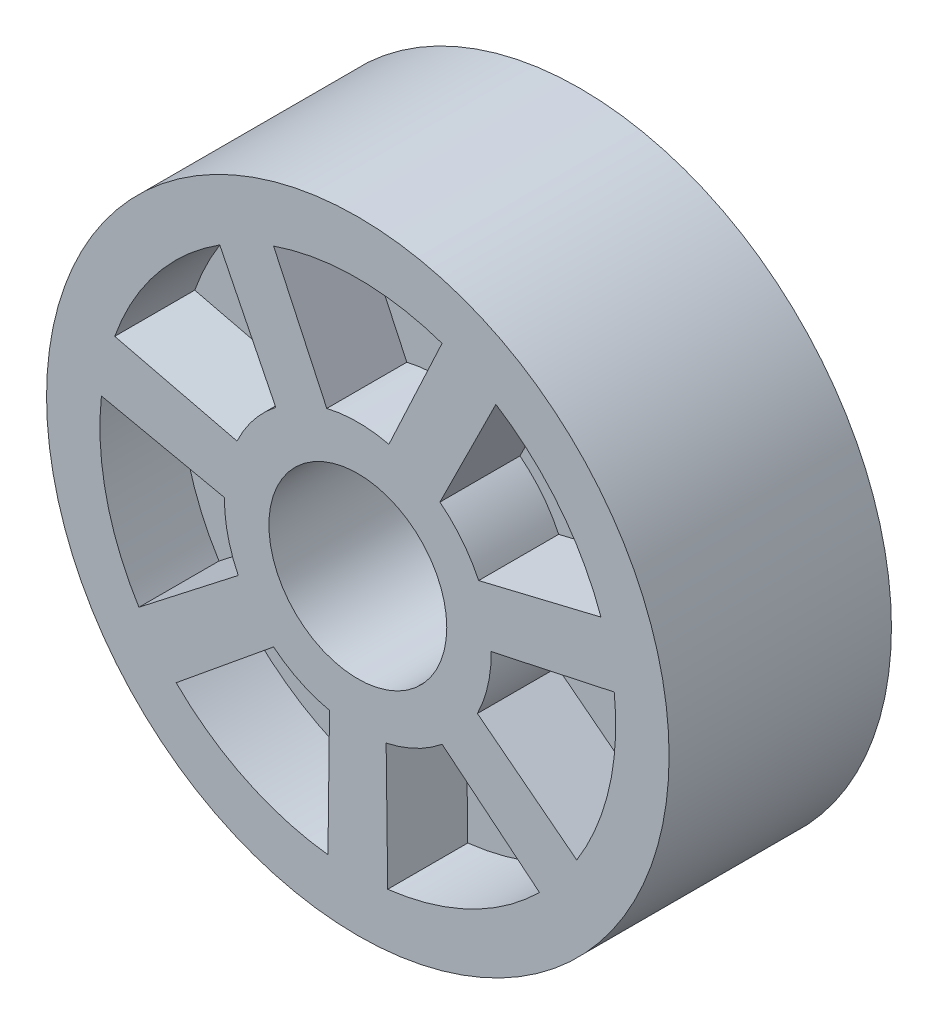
SolidWorks part; units mm, degrees
ref_plane "Front" through (0, 0, 0) normal (0, 0, 1) x (1, 0, 0)
ref_plane "Top" through (0, 0, 0) normal (0, 1, 0) x (1, 0, 0)
ref_plane "Right" through (0, 0, 0) normal (1, 0, 0) x (0, 0, -1)
sketch "Skizze1" plane through (0, 0, 0) normal (0, 0, 1) x (1, 0, 0)
  circle A0 centre (0, 0) radius 35
  circle A1 centre (0, 0) radius 10
  dimension "D1" = 20
  dimension "D2" = 70
extrude "Linear austragen1" add sketch "Skizze1" along normal mid plane 25
sketch "Skizze2" plane through (0, 0, 12.5) normal (0, 0, 1) x (1, 0, 0)
  line L0 (3.4923, 14.5878) -> (9.4713, 27.4098)
  line L1 (-3.4923, 14.5878) -> (-9.4713, 27.4098)
  circle A0 centre (0, 0) radius 3 construction
  arc A1 (3.4923, 14.5878) -> (-3.4923, 14.5878) centre (0, 0) ccw
  arc A2 (9.4713, 27.4098) -> (-9.4713, 27.4098) centre (0, 0) ccw
  circle A3 centre (0, 0) radius 10 construction
  dimension "D1" = 58
  dimension "D2" = 5
  dimension "D3" = 6
  dimension "D4" = 50
extrude "Schnitt-Linear austragen1" cut sketch "Skizze2" against normal blind 9
sketch "Skizze3" plane through (0, 0, -12.5) normal (0, 0, -1) x (-1, 0, 0)
  line L2 (-9.4713, 27.4098) -> (-3.4923, 14.5878)
  line L3 (3.4923, 14.5878) -> (9.4713, 27.4098)
  line L4 (-9.4713, 27.4098) -> (-3.4923, 14.5878)
  line L5 (3.4923, 14.5878) -> (9.4713, 27.4098)
  arc A2 (3.4923, 14.5878) -> (-3.4923, 14.5878) centre (0, 0) ccw
  arc A3 (9.4713, 27.4098) -> (-9.4713, 27.4098) centre (0, 0) ccw
  arc A4 (3.4923, 14.5878) -> (-3.4923, 14.5878) centre (0, 0) ccw
  arc A5 (9.4713, 27.4098) -> (-9.4713, 27.4098) centre (0, 0) ccw
  dimension "D1" = 0
extrude "Schnitt-Linear austragen2" cut sketch "Skizze3" against normal blind 9
pattern_circular "Kreismuster1" count 7 over 360 about axis through (0, 0, 0) along (0, 0, 1) of "Schnitt-Linear austragen1", "Schnitt-Linear austragen2"
